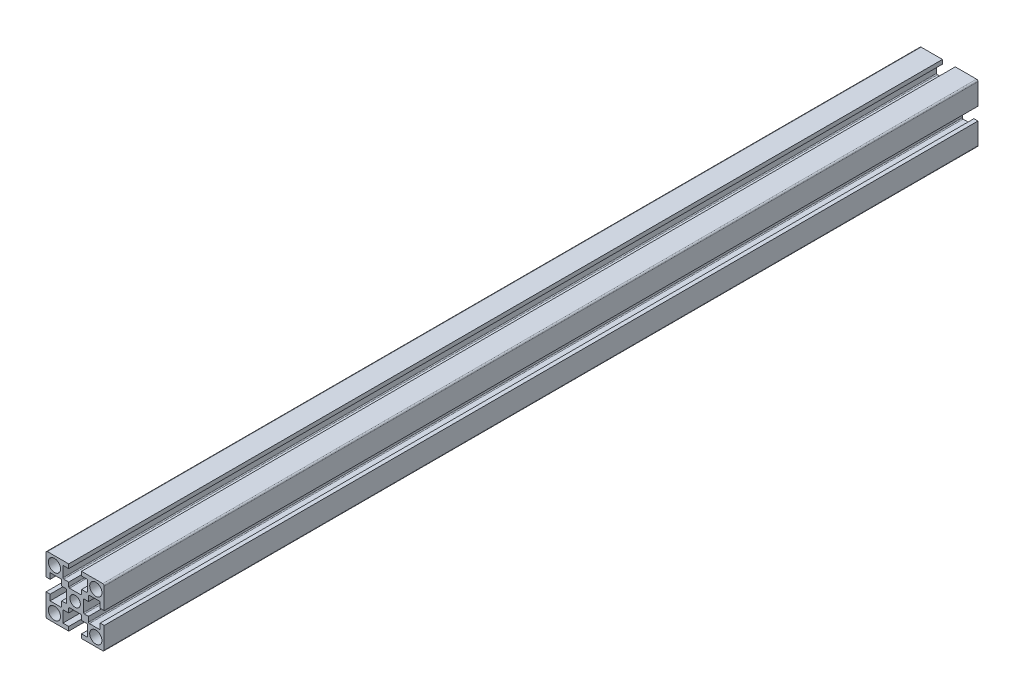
SolidWorks part; units mm, degrees
ref_plane "前视基准面" through (0, 0, 0) normal (0, 0, 1) x (1, 0, 0)
ref_plane "上视基准面" through (0, 0, 0) normal (0, 1, 0) x (1, 0, 0)
ref_plane "右视基准面" through (0, 0, 0) normal (1, 0, 0) x (0, 0, -1)
sketch "草图1" plane through (0, 0, 0) normal (0, 0, 1) x (1, 0, 0)
  line B0 (2.2, -3.2) -> (2.2, -4.6)
  line B1 (2.2, -4.6) -> (3.9, -4.6)
  line B2 (4.2, -4.9) -> (4.2, -8.6)
  line B3 (4.2, -8.6) -> (2.2, -8.6)
  line B4 (2.2, -8.6) -> (2.2, -10)
  line B5 (2.2, -10) -> (9.5, -10)
  line B6 (10, -9.5) -> (10, -2.2)
  line B7 (10, -2.2) -> (8.6, -2.2)
  line B8 (8.6, -2.2) -> (8.6, -4.2)
  line B9 (8.6, -4.2) -> (4.9, -4.2)
  line B10 (4.6, -3.9) -> (4.6, -2.2)
  line B11 (4.6, -2.2) -> (3.2, -2.2)
  line B12 (2.9, -1.9) -> (2.9, 1.9)
  line B13 (3.2, 2.2) -> (4.6, 2.2)
  line B14 (4.6, 2.2) -> (4.6, 3.9)
  line B15 (4.9, 4.2) -> (8.6, 4.2)
  line B16 (8.6, 4.2) -> (8.6, 2.2)
  line B17 (8.6, 2.2) -> (10, 2.2)
  line B18 (10, 2.2) -> (10, 9.5)
  line B19 (9.5, 10) -> (2.2, 10)
  line B20 (2.2, 10) -> (2.2, 8.6)
  line B21 (2.2, 8.6) -> (4.2, 8.6)
  line B22 (4.2, 8.6) -> (4.2, 4.9)
  line B23 (3.9, 4.6) -> (2.2, 4.6)
  line B24 (2.2, 4.6) -> (2.2, 3.2)
  line B25 (1.9, 2.9) -> (-1.9, 2.9)
  line B26 (-2.2, 3.2) -> (-2.2, 4.6)
  line B27 (-2.2, 4.6) -> (-3.9, 4.6)
  line B28 (-4.2, 4.9) -> (-4.2, 8.6)
  line B29 (-4.2, 8.6) -> (-2.2, 8.6)
  line B30 (-2.2, 8.6) -> (-2.2, 10)
  line B31 (-2.2, 10) -> (-9.5, 10)
  line B32 (-10, 9.5) -> (-10, 2.2)
  line B33 (-10, 2.2) -> (-8.6, 2.2)
  line B34 (-8.6, 2.2) -> (-8.6, 4.2)
  line B35 (-8.6, 4.2) -> (-4.9, 4.2)
  line B36 (-4.6, 3.9) -> (-4.6, 2.2)
  line B37 (-4.6, 2.2) -> (-3.2, 2.2)
  line B38 (-2.9, 1.9) -> (-2.9, -1.9)
  line B39 (-3.2, -2.2) -> (-4.6, -2.2)
  line B40 (-4.6, -2.2) -> (-4.6, -3.9)
  line B41 (-4.9, -4.2) -> (-8.6, -4.2)
  line B42 (-8.6, -4.2) -> (-8.6, -2.2)
  line B43 (-8.6, -2.2) -> (-10, -2.2)
  line B44 (-10, -2.2) -> (-10, -9.5)
  line B45 (-9.5, -10) -> (-2.2, -10)
  line B46 (-2.2, -10) -> (-2.2, -8.6)
  line B47 (-2.2, -8.6) -> (-4.2, -8.6)
  line B48 (-4.2, -8.6) -> (-4.2, -4.9)
  line B49 (-3.9, -4.6) -> (-2.2, -4.6)
  line B50 (-2.2, -4.6) -> (-2.2, -3.2)
  line B51 (-1.9, -2.9) -> (1.9, -2.9)
  circle B52 centre (7.1, 7.1) radius 2.1
  circle B53 centre (7.1, -7.1) radius 2.1
  circle B54 centre (0, 0) radius 1.8
  circle B55 centre (-7.1, -7.1) radius 2.1
  circle B56 centre (-7.1, 7.1) radius 2.1
  arc B57 (4.2, -4.9) -> (3.9, -4.6) centre (3.9, -4.9) ccw
  arc B58 (9.5, -10) -> (10, -9.5) centre (9.5, -9.5) ccw
  arc B59 (4.6, -3.9) -> (4.9, -4.2) centre (4.9, -3.9) ccw
  arc B60 (2.9, -1.9) -> (3.2, -2.2) centre (3.2, -1.9) ccw
  arc B61 (3.2, 2.2) -> (2.9, 1.9) centre (3.2, 1.9) ccw
  arc B62 (4.9, 4.2) -> (4.6, 3.9) centre (4.9, 3.9) ccw
  arc B63 (10, 9.5) -> (9.5, 10) centre (9.5, 9.5) ccw
  arc B64 (3.9, 4.6) -> (4.2, 4.9) centre (3.9, 4.9) ccw
  arc B65 (1.9, 2.9) -> (2.2, 3.2) centre (1.9, 3.2) ccw
  arc B66 (-2.2, 3.2) -> (-1.9, 2.9) centre (-1.9, 3.2) ccw
  arc B67 (-4.2, 4.9) -> (-3.9, 4.6) centre (-3.9, 4.9) ccw
  arc B68 (-9.5, 10) -> (-10, 9.5) centre (-9.5, 9.5) ccw
  arc B69 (-4.6, 3.9) -> (-4.9, 4.2) centre (-4.9, 3.9) ccw
  arc B70 (-2.9, 1.9) -> (-3.2, 2.2) centre (-3.2, 1.9) ccw
  arc B71 (-3.2, -2.2) -> (-2.9, -1.9) centre (-3.2, -1.9) ccw
  arc B72 (-4.9, -4.2) -> (-4.6, -3.9) centre (-4.9, -3.9) ccw
  arc B73 (-10, -9.5) -> (-9.5, -10) centre (-9.5, -9.5) ccw
  arc B74 (-3.9, -4.6) -> (-4.2, -4.9) centre (-3.9, -4.9) ccw
  arc B75 (-1.9, -2.9) -> (-2.2, -3.2) centre (-1.9, -3.2) ccw
  arc B76 (2.2, -3.2) -> (1.9, -2.9) centre (1.9, -3.2) ccw
sketch_block_instance "A$C5F913A84-1"
sketch_block "A$C5F913A84"
extrude "凸台-拉伸1" add sketch "草图1" along normal mid plane 300
